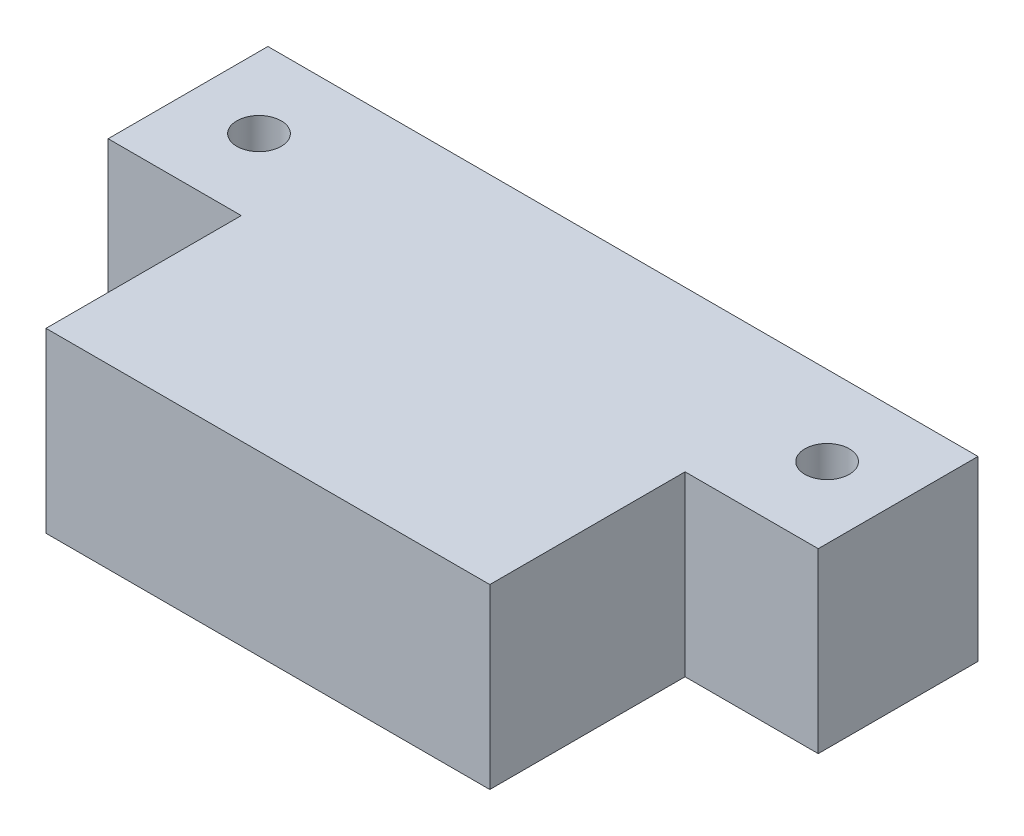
SolidWorks part; units mm, degrees
ref_plane "Alzado" through (0, 0, 0) normal (0, 0, 1) x (1, 0, 0)
ref_plane "Planta" through (0, 0, 0) normal (0, 1, 0) x (1, 0, 0)
ref_plane "Vista lateral" through (0, 0, 0) normal (1, 0, 0) x (0, 0, -1)
sketch "Croquis1" plane through (0, 0, 0) normal (0, 1, 0) x (1, 0, 0)
  line L0 (0, 20) -> (0, -20) construction
  line L1 (-25, -20) -> (25, -20)
  line L2 (-40, 2) -> (-40, 20)
  line L3 (-40, 20) -> (40, 20)
  line L4 (40, 2) -> (40, 20)
  line L5 (-25, -12.5) -> (40, 20) construction
  line L6 (-40, 20) -> (25, -12.5) construction
  line L7 (-25, -20) -> (-25, 2)
  line L8 (25, -20) -> (25, 2)
  line L9 (-25, 2) -> (-40, 2)
  line L10 (25, 2) -> (40, 2)
  point P0 (0, 0)
  dimension "D2" = 80
  dimension "D3" = 25
  dimension "D4" = 22
  dimension "D5" = 22
extrude "Saliente-Extruir1" add sketch "Croquis1" along normal blind 20
sketch "Croquis2" plane through (0, 20, 0) normal (0, 1, 0) x (1, 0, 0)
  line L0 (-32, 20) -> (-32, 2) construction
  line L1 (40, 20) -> (-40, 20) construction
  line L2 (-40, 2) -> (-25, 2) construction
  line L3 (-40, 20) -> (-40, 2) construction
  circle A0 centre (-32, 11) radius 2.5
  point P8 (-32, 11)
  dimension "D2" = 5
  dimension "D1" = 8
extrude "Cortar-Extruir1" cut sketch "Croquis2" against normal blind 20
sketch "Croquis3" plane through (0, 20, 0) normal (0, 1, 0) x (1, 0, 0)
  line L0 (0, 20) -> (0, -20) construction
  line L1 (40, 20) -> (-40, 20) construction
  line L2 (-25, -20) -> (25, -20) construction
  line L3 (32, 20) -> (32, 2) construction
  line L4 (25, 2) -> (40, 2) construction
  line L5 (40, 2) -> (40, 20) construction
  circle A0 centre (32, 11) radius 2.5
  dimension "D2" = 5
  dimension "D1" = 8
extrude "Cortar-Extruir2" cut sketch "Croquis3" against normal blind 20
